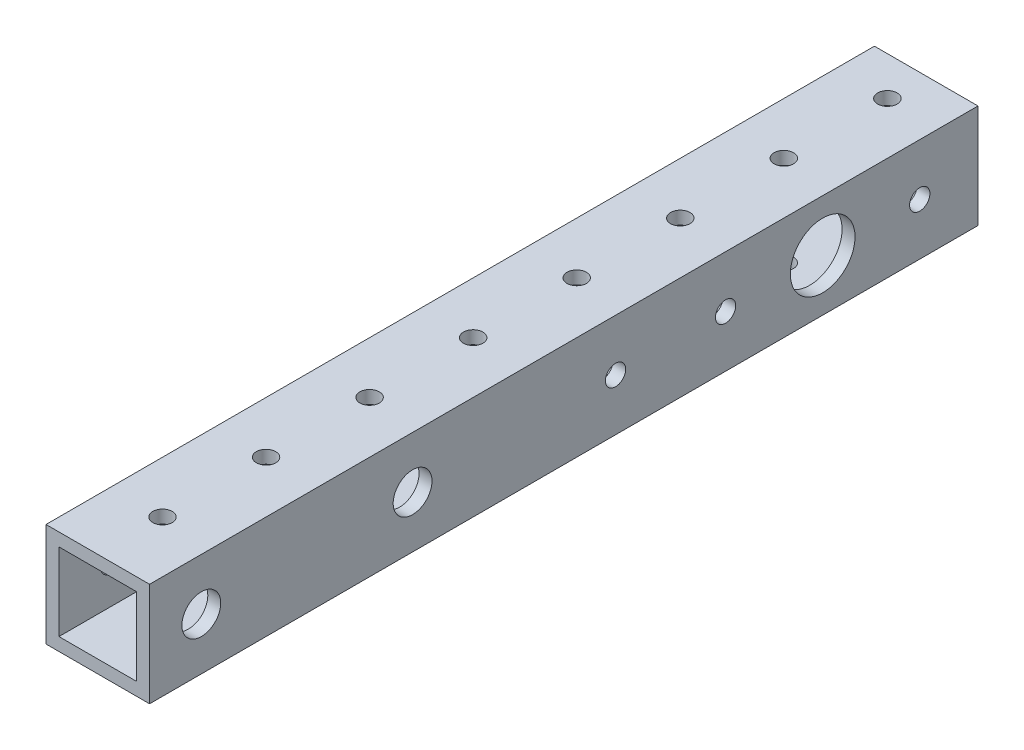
SolidWorks part; units mm, degrees
ref_plane "Front Plane" through (0, 0, 0) normal (0, 0, 1) x (1, 0, 0)
ref_plane "Top Plane" through (0, 0, 0) normal (0, 1, 0) x (1, 0, 0)
ref_plane "Right Plane" through (0, 0, 0) normal (1, 0, 0) x (0, 0, -1)
sketch "Sketch1" plane through (0, 0, 0) normal (0, 0, 1) x (1, 0, 0)
  line L1 (-12.7, -12.7) -> (12.7, -12.7)
  line L2 (-12.7, -12.7) -> (-12.7, 12.7)
  line L3 (-12.7, 12.7) -> (12.7, 12.7)
  line L4 (12.7, -12.7) -> (12.7, 12.7)
  line L5 (-12.7, -12.7) -> (12.7, 12.7) construction
  line L6 (-12.7, 12.7) -> (12.7, -12.7) construction
  line L7 (-9.525, -9.525) -> (9.525, -9.525)
  line L8 (-9.525, -9.525) -> (-9.525, 9.525)
  line L9 (-9.525, 9.525) -> (9.525, 9.525)
  line L10 (9.525, -9.525) -> (9.525, 9.525)
  line L11 (-9.525, -9.525) -> (9.525, 9.525) construction
  line L12 (-9.525, 9.525) -> (9.525, -9.525) construction
  point P0 (0, 0)
  point P6 (0, 0)
  dimension "D1" = 25.4
  dimension "D2" = 3.175
extrude "Boss-Extrude1" add sketch "Sketch1" along normal mid plane 203.2
sketch "Sketch2" plane through (12.7, 0, 0) normal (1, 0, 0) x (0, 0, -1)
  line L0 (-101.6, -12.7) -> (-101.6, 12.7) construction
  line L1 (15.8048, 0) -> (-207.087, 0) construction
  line L3 (87.3125, 0) -> (39.6875, 0) construction
  circle A0 centre (12.7, 0) radius 2.4892
  circle A1 centre (39.6875, 0) radius 2.4892
  circle A2 centre (63.5, 0) radius 2.4384
  circle A3 centre (87.3125, 0) radius 2.4892
  point P13 (63.5, 0)
  dimension "D2" = 4.9784
  dimension "D3" = 50.8
  dimension "D4" = 4.8768
  dimension "D5" = 4.9784
  dimension "D1" = 114.3
  dimension "D6" = 47.625
extrude "Cut-Extrude1" cut sketch "Sketch2" against normal through all
sketch "Sketch3" plane through (0, 12.7, 0) normal (0, 1, 0) x (1, 0, 0)
  line L0 (0, 4.5044) -> (0, -99.9796) construction
  line L1 (12.7, 101.6) -> (-12.7, 101.6) construction
  circle A0 centre (0, 92.075) radius 2.3812
  dimension "D1" = 4.7625
  dimension "D2" = 9.525
extrude "Cut-Extrude2" cut sketch "Sketch3" against normal through all
pattern_linear "LPattern1" count 8 spacing 25.4 along (0, 0, 1) of "Cut-Extrude2"
sketch "Sketch4" plane through (-12.7, 0, 0) normal (-1, 0, 0) x (0, 0, 1)
  circle A0 centre (-87.3125, 0) radius 4.7625
  circle A1 centre (-39.6875, 0) radius 4.7625
  dimension "D1" = 9.525
  dimension "D2" = 9.525
extrude "Cut-Extrude3" cut sketch "Sketch4" against normal up to next
sketch "Sketch5" plane through (-12.7, 0, 0) normal (-1, 0, 0) x (0, 0, 1)
  line L0 (101.6, 12.7) -> (-101.6, 12.7) construction
  line L3 (101.6, -12.7) -> (-101.6, -12.7) construction
  line L4 (101.6, 12.7) -> (101.6, -12.7) construction
  circle A0 centre (88.9, 0) radius 2.4892
  circle A1 centre (37.084, 0) radius 2.4892
  dimension "D2" = 4.9784
  dimension "D3" = 12.7
  dimension "D4" = 12.7
  dimension "D5" = 12.7
  dimension "D1" = 51.816
extrude "Cut-Extrude4" cut sketch "Sketch5" against normal up to next
sketch "Sketch6" plane through (12.7, 0, 0) normal (1, 0, 0) x (0, 0, -1)
  circle A0 centre (-88.9, 0) radius 4.7625
  circle A1 centre (-37.084, 0) radius 4.7625
  dimension "D1" = 9.525
extrude "Cut-Extrude5" cut sketch "Sketch6" against normal up to next
sketch "Sketch7" plane through (-9.525, 0, 0) normal (1, 0, 0) x (0, 0, -1)
  line L4 (101.6, -9.525) -> (101.6, 9.525)
  line L5 (101.6, 9.525) -> (-101.6, 9.525)
  line L6 (-101.6, 9.525) -> (-101.6, -9.525)
  line L7 (-101.6, -9.525) -> (101.6, -9.525)
  line L8 (101.6, -9.525) -> (101.6, 9.525)
  line L9 (101.6, 9.525) -> (-101.6, 9.525)
  line L10 (-101.6, 9.525) -> (-101.6, -9.525)
  line L11 (-101.6, -9.525) -> (101.6, -9.525)
  circle A0 centre (12.7, 0) radius 4.7625
  dimension "D2" = 9.525
  dimension "D1" = 0
extrude "Cut-Extrude6" cut sketch "Sketch7" against normal up to next contours A0
sketch "Sketch8" plane through (12.7, 0, 0) normal (-1, 0, 0) x (0, 0, 1)
  circle A0 centre (-63.5, 0) radius 7.9375
  dimension "D1" = 15.875
extrude "Cut-Extrude7" cut sketch "Sketch8" along normal up to next
